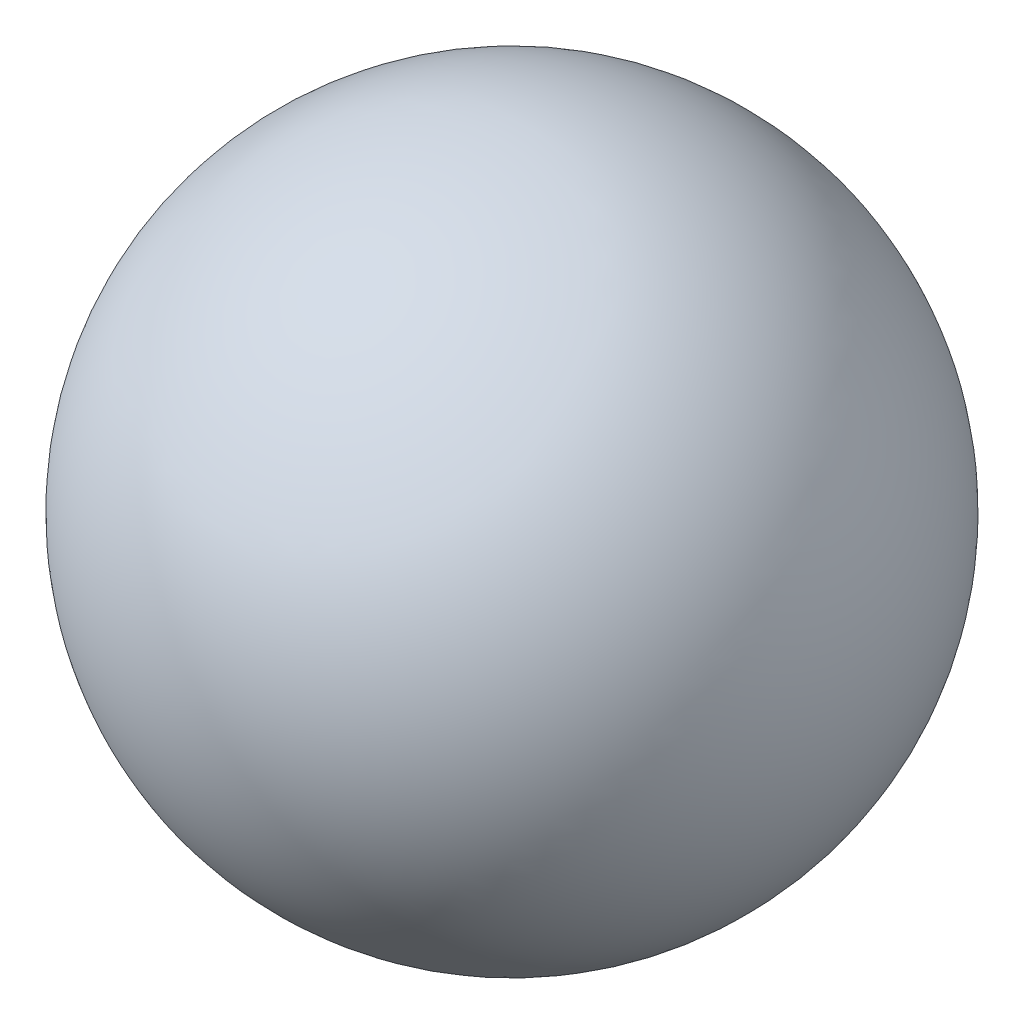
SolidWorks part; units mm, degrees
ref_plane "Front Plane" through (0, 0, 0) normal (0, 0, 1) x (1, 0, 0)
ref_plane "Top Plane" through (0, 0, 0) normal (0, 1, 0) x (1, 0, 0)
ref_plane "Right Plane" through (0, 0, 0) normal (1, 0, 0) x (0, 0, -1)
sketch "Sketch1" plane through (0, 0, 0) normal (0, 1, 0) x (1, 0, 0)
  line L0 (0, 7.9375) -> (0, -7.9375)
  circle A0 centre (0, 0) radius 7.9375
  dimension "D1" = 15.875
revolve "Revolve1" add sketch "Sketch1" angle 360 about L0
